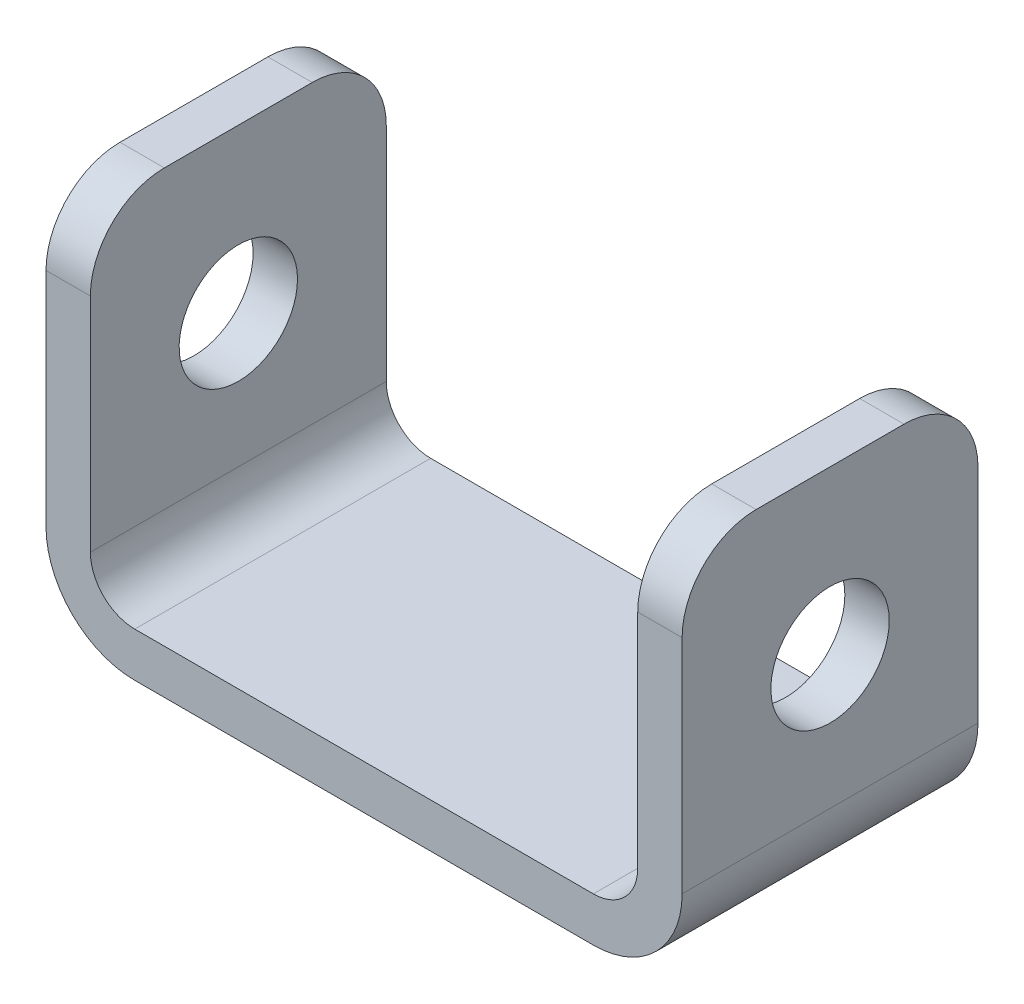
SolidWorks part; units mm, degrees
ref_plane "Plan1" through (0, 0, 0) normal (0, 0, 1) x (1, 0, 0)
ref_plane "Plan2" through (0, 0, 0) normal (0, 1, 0) x (1, 0, 0)
ref_plane "Plan3" through (0, 0, 0) normal (1, 0, 0) x (0, 0, -1)
sketch "Esquisse1" plane through (0, 0, 0) normal (0, 0, 1) x (1, 0, 0)
  line L0 (-15.5, 0) -> (15.5, 0)
  line L1 (-21.5, 6) -> (-21.5, 26)
  line L2 (21.5, 6) -> (21.5, 26)
  line L3 (21.5, 26) -> (18.5, 26)
  line L4 (18.5, 26) -> (18.5, 6)
  line L5 (15.5, 3) -> (-15.5, 3)
  line L6 (-18.5, 6) -> (-18.5, 26)
  line L7 (-18.5, 26) -> (-21.5, 26)
  arc A0 (-15.5, 3) -> (-18.5, 6) centre (-15.5, 6) cw
  arc A1 (15.5, 3) -> (18.5, 6) centre (15.5, 6) ccw
  arc A2 (-15.5, 0) -> (-21.5, 6) centre (-15.5, 6) cw
  arc A3 (21.5, 6) -> (15.5, 0) centre (15.5, 6) cw
  point P15 (-21.5, 0)
  dimension "D7" = 3
  dimension "D8" = 6
  dimension "D1" = 3
  dimension "D2" = 3
  dimension "D3" = 3
  dimension "D4" = 37
  dimension "D5" = 21.5
  dimension "D6" = 26
extrude "Base-Extrusion" add sketch "Esquisse1" along normal mid plane 20
fillet "Congé1" radius 5
sketch "Esquisse2" plane through (21.5, 0, 0) normal (1, 0, 0) x (0, 0, -1)
  circle A0 centre (0, 15) radius 4
  dimension "D1" = 8
  dimension "D2" = 15
extrude "Enlèv. mat.-Extru.1" cut sketch "Esquisse2" against normal through all
